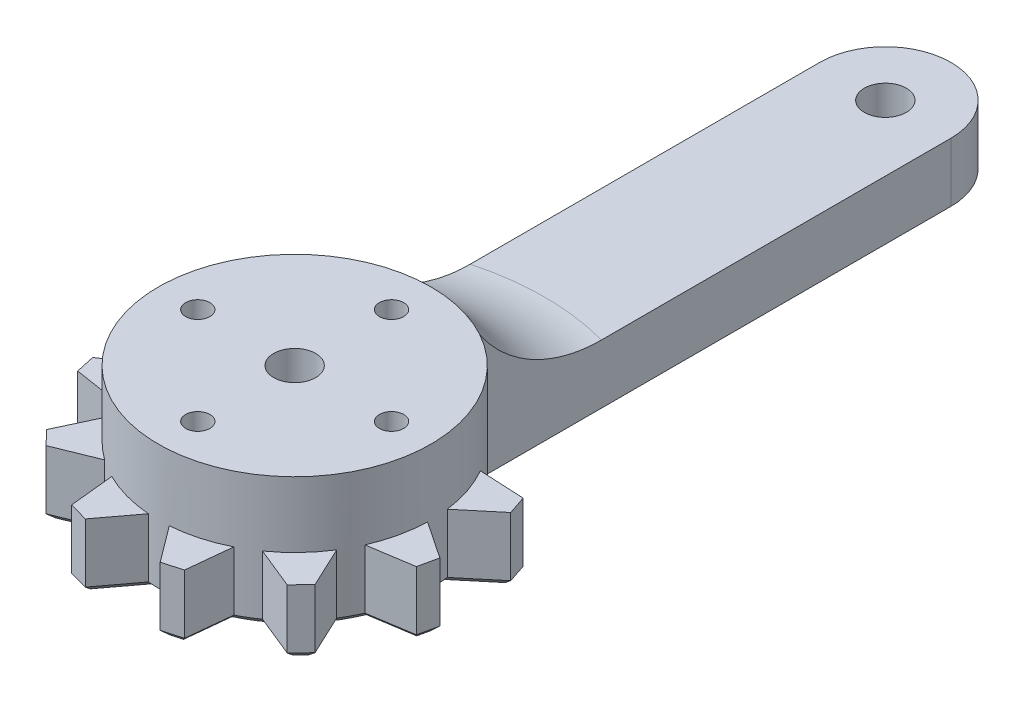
SolidWorks part; units mm, degrees
ref_plane "Front Plane" through (0, 0, 0) normal (0, 0, 1) x (1, 0, 0)
ref_plane "Top Plane" through (0, 0, 0) normal (0, 1, 0) x (1, 0, 0)
ref_plane "Right Plane" through (0, 0, 0) normal (1, 0, 0) x (0, 0, -1)
sketch "Sketch1" plane through (0, 0, 0) normal (0, 1, 0) x (1, 0, 0)
  line L0 (0, 0) -> (0, 45) construction
  line L1 (-5, 0) -> (-5, 45)
  line L2 (5, 0) -> (5, 45)
  circle A0 centre (0, 0) radius 10.38
  arc A1 (-5, 0) -> (5, 0) centre (0, 0) ccw
  arc A2 (5, 45) -> (-5, 45) centre (0, 45) ccw
  circle A3 centre (0, 45) radius 1.6
  circle A4 centre (0, 0) radius 1.6
  point P3 (0, 22.5)
  dimension "D1" = 20.76
  dimension "D4" = 3.2
  dimension "D5" = 3.2
  dimension "D2" = 10
  dimension "D3" = 45
extrude "Boss-Extrude1" add sketch "Sketch1" along normal blind 5
sketch "Sketch2" plane through (0, 5, 0) normal (0, 1, 0) x (1, 0, 0)
  line L0 (-3.5756, -12.8934) -> (-2.7739, -10.0025) construction
  line L1 (-4.2984, -12.6929) -> (-2.8529, -13.0938)
  line L2 (-2.8529, -13.0938) -> (-0.7947, -10.3495)
  line L3 (-4.2984, -12.6929) -> (-4.6492, -9.2806)
  line L4 (0, -2.75) -> (0, 2.75) construction
  arc A0 (-5, 9.0964) -> (5, 9.0964) centre (0, 0) ccw construction
  arc A1 (-4.6492, -9.2806) -> (-0.7947, -10.3495) centre (0, 0) ccw
  point P14 (-3.5756, -12.8934)
  dimension "D1" = 3
  dimension "D2" = 1.5
  dimension "D3" = 4
  dimension "D4" = 15.5
extrude "Boss-Extrude2" add sketch "Sketch2" against normal up to surface (5 mm away)
pattern_circular "CirPattern1" count 5 every 31 about axis through (0, 0, 0) along (0, 1, 0) of "Boss-Extrude2"
sketch "Sketch5" plane through (0, 5, 0) normal (0, 1, 0) x (1, 0, 0)
  circle A0 centre (0, 0) radius 10.38
  circle A3 centre (0, 0) radius 1.6
  circle A4 centre (0, 0) radius 7.38 construction
  circle A5 centre (0, 7.38) radius 0.925
  circle A6 centre (0, -7.38) radius 0.925
  arc A8 (-8.1358, 6.4462) -> (-9.0245, 5.1286) centre (0, 0) ccw construction
  circle A9 centre (-7.38, 0) radius 0.925
  circle A10 centre (7.38, 0) radius 0.925
  dimension "D1" = 1.85
  dimension "D2" = 3
extrude "Boss-Extrude4" add sketch "Sketch5" along normal blind 5
fillet "Fillet1" radius 10 1 edges at (0, 5, -10.38)
chamfer "Chamfer1" distance 0.5 angle 45 42 edges at (-5.0471, 0, -9.0703) (10.3658, 0, -0.5432) (11.2058, 0, 3.8927) (11.8011, 0, 1.2078) (13.0628, 0, 2.896) (-5, 0, -27.0482) (7.2875, 0, -7.3917) (11.6102, 0, -2.4348) (10.7376, 0, -5.0427) (12.6886, 0, -4.2455) (0, 0, 10.38) (-4.4738, 0, 10.9868) (-1.8238, 0, 11.7217) (-3.5756, 0, 12.8934) (-5.3461, 0, 8.8974) (-9.4934, 0, 7.1133) (-7.6004, 0, 9.1081) (-9.7055, 0, 9.2102) (-9.165, 0, 4.8731) (-11.8011, 0, 1.2078) (-11.2058, 0, 3.8927) (-13.0628, 0, 2.896) (-10.3658, 0, -0.5432) (-10.7376, 0, -5.0427) (-11.6102, 0, -2.4348) (-12.6886, 0, -4.2455) (-8.6054, 0, -5.8044) (-6.6067, 0, -9.8527) (-8.6978, 0, -8.0667) (-8.6896, 0, -10.1742) (5.3461, 0, 8.8974) (0, 0, 1.6) (1.8238, 0, 11.7217) (4.4738, 0, 10.9868) (3.5756, 0, 12.8934) (0, 0, -43.4) (0, 0, -50) (9.165, 0, 4.8731) (7.6004, 0, 9.1081) (9.4934, 0, 7.1133) (9.7055, 0, 9.2102) (5, 0, -27.0482)
